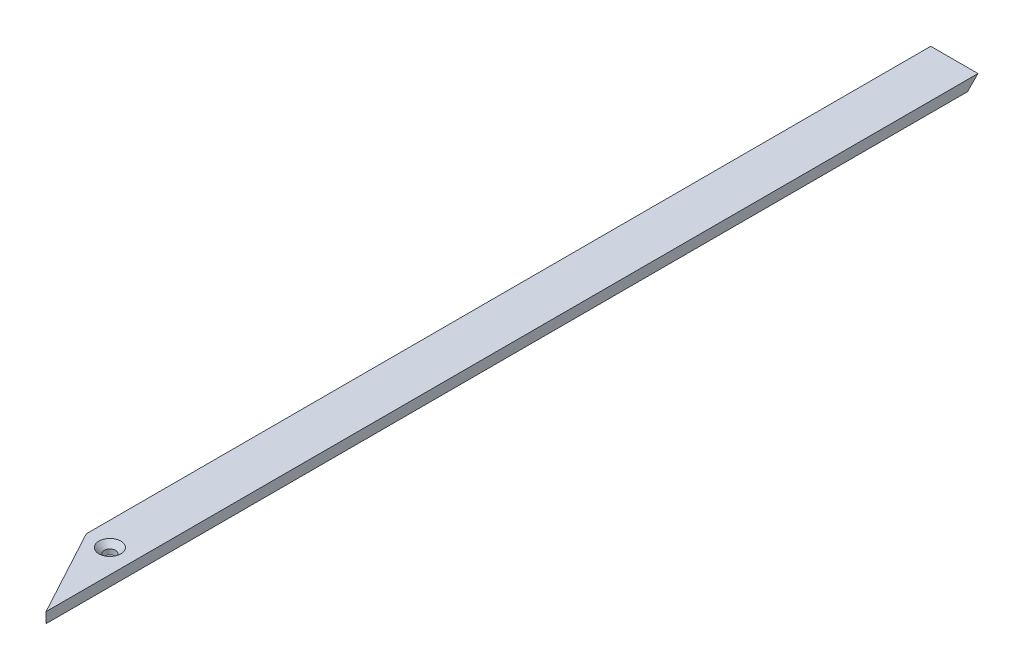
SolidWorks part; units mm, degrees
ref_plane "Plan de face" through (0, 0, 0) normal (0, 0, 1) x (1, 0, 0)
ref_plane "Plan de dessus" through (0, 0, 0) normal (0, 1, 0) x (1, 0, 0)
ref_plane "Plan de droite" through (0, 0, 0) normal (1, 0, 0) x (0, 0, -1)
sketch "Esquisse1" plane through (0, 0, 0) normal (0, 0, 1) x (1, 0, 0)
  line L1 (-13.5, 0) -> (13.5, 0)
  line L2 (-13.5, 0) -> (-13.5, 6)
  line L3 (-13.5, 6) -> (13.5, 6)
  line L4 (13.5, 0) -> (13.5, 6)
  point P4 (0, 0)
  dimension "D1" = 27
  dimension "D2" = 6
extrude "Extrusion1" add sketch "Esquisse1" along normal mid plane 532.5
hole_wizard "Fraisage pour vis à tête fraisée M61" positions "Esquisse3" profile "Esquisse2" countersink size "M6" standard "ISO"
sketch "Esquisse3" plane through (0, 6, 0) normal (0, 1, 0) x (-1, 0, 0)
  line L1 (-13.5, 266.25) -> (-13.5, -266.25) construction
  line L2 (-13.5, 266.25) -> (13.5, 266.25) construction
  point P0 (0, 216.25)
  dimension "D1" = 50
  dimension "D2" = 13.5
sketch "Esquisse2" plane through (0, 6, 216.25) normal (1, 0, 0) x (0, 0, 1)
  line L0 (0, 0) -> (0, 6)
  line L1 (0, 6) -> (3.25, 6)
  line L2 (3.25, 6) -> (3.25, 3.05)
  line L3 (3.25, 3.05) -> (6.3, 0)
  line L5 (6.3, 0) -> (0, 0)
  line L6 (-3.25, 3.05) -> (-6.3, 0) construction
  line L11 (0, -6.35) -> (0, 107.95) construction
  dimension "Diamètre du perçage jusqu'au prochain" = 6.5
  dimension "Profondeur du perçage jusqu'au prochain" = 6
  dimension "Diamètre du fraisage entrant" = 12.6
  dimension "Angle du fraisage entrant" = 90
chamfer "Chanfrein3" distance 50 distance2 27 1 edges at (-13.5, 3, 266.25)
chamfer "Chanfrein4" distance 6 angle 45 1 edges at (0, 0, -266.25)
